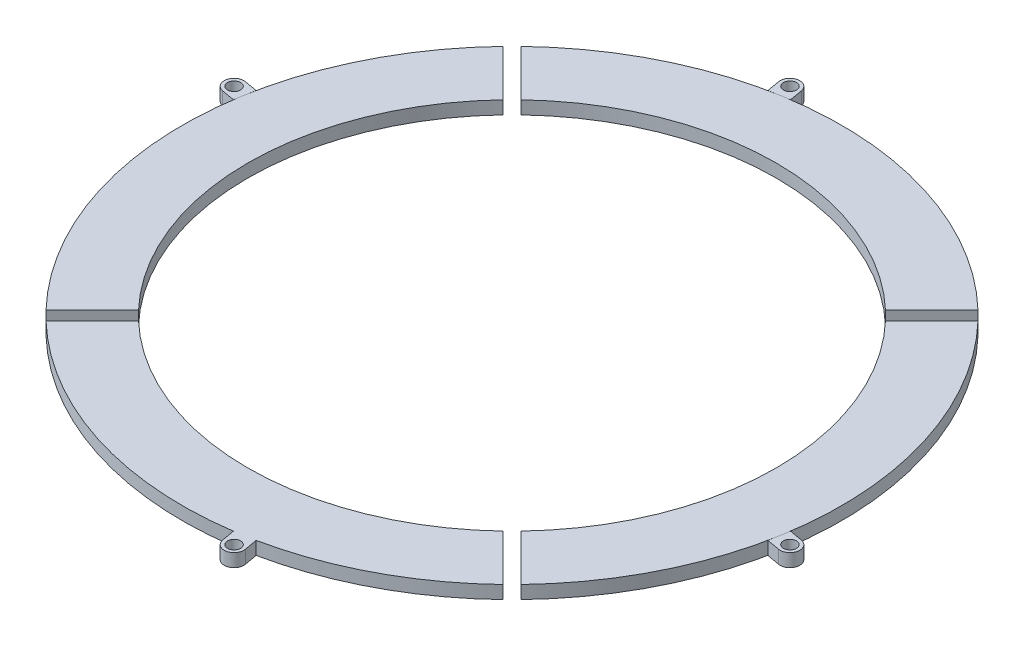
SolidWorks part; units mm, degrees
ref_plane "前视基准面" through (0, 0, 0) normal (0, 0, 1) x (1, 0, 0)
ref_plane "上视基准面" through (0, 0, 0) normal (0, 1, 0) x (1, 0, 0)
ref_plane "右视基准面" through (0, 0, 0) normal (1, 0, 0) x (0, 0, -1)
sketch "草图1" plane through (0, 0, 0) normal (0, 1, 0) x (1, 0, 0)
  line L0 (0, 28.5318) -> (0, -43.5615) construction
  line L1 (-12.686, 12.686) -> (30.0127, -30.0127) construction
  line L2 (0.7071, -0.7071) -> (71.4178, 70.0036)
  line L3 (71.4178, 70.0036) -> (70.0036, 71.4178)
  line L4 (70.0036, 71.4178) -> (-0.7071, 0.7071)
  line L5 (-0.7071, 0.7071) -> (0.7071, -0.7071)
  line L6 (0.7071, 0.7071) -> (-0.7071, -0.7071)
  line L7 (-0.7071, -0.7071) -> (70.0036, -71.4178)
  line L8 (70.0036, -71.4178) -> (71.4178, -70.0036)
  line L9 (71.4178, -70.0036) -> (0.7071, 0.7071)
  line L10 (0.7071, -0.7071) -> (-0.7071, 0.7071)
  line L11 (-0.7071, 0.7071) -> (-71.4178, -70.0036)
  line L12 (-71.4178, -70.0036) -> (-70.0036, -71.4178)
  line L13 (-70.0036, -71.4178) -> (0.7071, -0.7071)
  line L14 (-0.7071, -0.7071) -> (0.7071, 0.7071)
  line L15 (0.7071, 0.7071) -> (-70.0036, 71.4178)
  line L16 (-70.0036, 71.4178) -> (-71.4178, 70.0036)
  line L17 (-71.4178, 70.0036) -> (-0.7071, -0.7071)
  circle A0 centre (0, 0) radius 40.4
  circle A1 centre (0, 0) radius 50.4
  point P10 (0, 0)
  point P28 (0, 0)
  dimension "D2" = 80.8
  dimension "D3" = 100.8
  dimension "D1" = 45
  dimension "D4" = 100
  dimension "D5" = 2
  dimension "D6" = 4
extrude "凸台-拉伸1" add sketch "草图1" along normal blind 2 contours L17 A1 L11 A0 | L4 A1 L15 A0 | L9 A1 L2 A0 | L13 A1 L7 A0
sketch "草图2" plane through (0, 0, 0) normal (0, -1, 0) x (1, 0, 0)
  line L2 (0, 0) -> (9.0992, 51.6039) construction
  line L3 (10.2252, 49.3519) -> (7.2708, 49.8728)
  line L4 (8.3898, 8.3898) -> (0, 0) construction
  line L5 (27.8513, -29.2655) -> (29.2655, -27.8513) construction
  line L9 (0, 0) -> (10.8745, -10.8745) construction
  line L10 (7.2708, 49.8728) -> (7.622, 51.8644)
  line L17 (27.8513, 29.2655) -> (29.2655, 27.8513) construction
  line L18 (10.2252, 49.3519) -> (10.5764, 51.3435)
  line L19 (49.3519, 10.2252) -> (51.3435, 10.5764)
  line L20 (49.8728, 7.2708) -> (51.8644, 7.622)
  line L21 (49.3519, 10.2252) -> (49.8728, 7.2708)
  line L22 (-49.3519, -10.2252) -> (-51.3435, -10.5764)
  line L23 (-49.8728, -7.2708) -> (-51.8644, -7.622)
  line L24 (-49.3519, -10.2252) -> (-49.8728, -7.2708)
  line L25 (-10.2252, -49.3519) -> (-7.2708, -49.8728)
  line L26 (-7.2708, -49.8728) -> (-7.622, -51.8644)
  line L27 (-10.2252, -49.3519) -> (-10.5764, -51.3435)
  arc A2 (34.9241, 36.3383) -> (-34.9241, 36.3383) centre (0, 0) ccw construction
  arc A6 (-27.8513, -29.2655) -> (27.8513, -29.2655) centre (0, 0) ccw construction
  arc A7 (-27.8513, -29.2655) -> (27.8513, -29.2655) centre (0, 0) ccw construction
  arc A8 (34.9241, 36.3383) -> (-34.9241, 36.3383) centre (0, 0) ccw construction
  arc A9 (10.5764, 51.3435) -> (7.622, 51.8644) centre (9.0992, 51.6039) ccw
  circle A10 centre (9.0992, 51.6039) radius 1
  circle A11 centre (51.6039, 9.0992) radius 1
  arc A12 (51.3435, 10.5764) -> (51.8644, 7.622) centre (51.6039, 9.0992) cw
  circle A13 centre (-51.6039, -9.0992) radius 1
  arc A14 (-51.3435, -10.5764) -> (-51.8644, -7.622) centre (-51.6039, -9.0992) cw
  arc A15 (-10.5764, -51.3435) -> (-7.622, -51.8644) centre (-9.0992, -51.6039) ccw
  circle A16 centre (-9.0992, -51.6039) radius 1
  point P2 (0, 0)
  point P7 (0, 0)
  point P9 (9.0588, 51.375)
  dimension "D1" = 2
  dimension "D4" = 52.4
  dimension "D2" = 1.5
  dimension "D3" = 35
extrude "凸台-拉伸2" add sketch "草图2" against normal up to surface (2 mm away)
